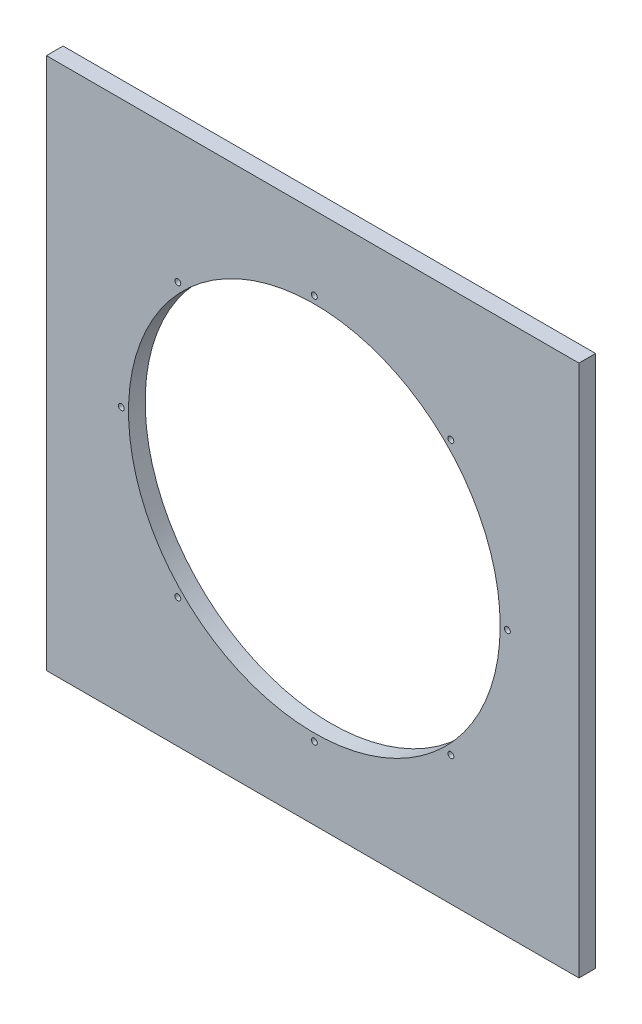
SolidWorks part; units mm, degrees
ref_plane "Front Plane" through (0, 0, 0) normal (0, 0, 1) x (1, 0, 0)
ref_plane "Top Plane" through (0, 0, 0) normal (0, 1, 0) x (1, 0, 0)
ref_plane "Right Plane" through (0, 0, 0) normal (1, 0, 0) x (0, 0, -1)
sketch "Sketch1" plane through (0, 0, 0) normal (0, 0, 1) x (1, 0, 0)
  line L1 (-304.8, 304.8) -> (304.8, 304.8)
  line L2 (-304.8, 304.8) -> (-304.8, -304.8)
  line L3 (-304.8, -304.8) -> (304.8, -304.8)
  line L4 (304.8, 304.8) -> (304.8, -304.8)
  line L5 (-304.8, 304.8) -> (304.8, -304.8) construction
  line L6 (-304.8, -304.8) -> (304.8, 304.8) construction
  point P0 (0, 0)
  dimension "D1" = 609.6
  dimension "D2" = 609.6
extrude "Boss-Extrude1" add sketch "Sketch1" along normal blind 19.05
sketch "Sketch2" plane through (0, 0, 19.05) normal (0, 0, 1) x (1, 0, 0)
  line L0 (1.9091, -0.7637) -> (1.9091, 220.2367) construction
  line L1 (158.18, 155.5072) -> (1.9091, -0.7637) construction
  circle A0 centre (1.9091, -0.7637) radius 212.725 construction
  circle A1 centre (1.9091, -0.7637) radius 266.7 construction
  circle A2 centre (1.9091, -0.7637) radius 221.0003 construction
  circle A3 centre (1.9091, 220.2367) radius 3.3655
  circle A4 centre (158.18, 155.5072) radius 3.3655
  circle A5 centre (222.9094, -0.7637) radius 3.3655
  circle A6 centre (158.18, -157.0345) radius 3.3655
  circle A7 centre (1.9091, -221.764) radius 3.3655
  circle A8 centre (-154.3617, -157.0345) radius 3.3655
  circle A9 centre (-219.0912, -0.7637) radius 3.3655
  circle A10 centre (-154.3617, 155.5072) radius 3.3655
  circle A11 centre (1.9091, -0.7637) radius 212.725
  point P21 (1.9091, -0.7637)
  dimension "D1" = 425.45
  dimension "D2" = 442.0006
  dimension "D3" = 6.731
  dimension "D5" = 425.45
  dimension "D4" = 45
extrude "Cut-Extrude1" cut sketch "Sketch2" against normal through all
